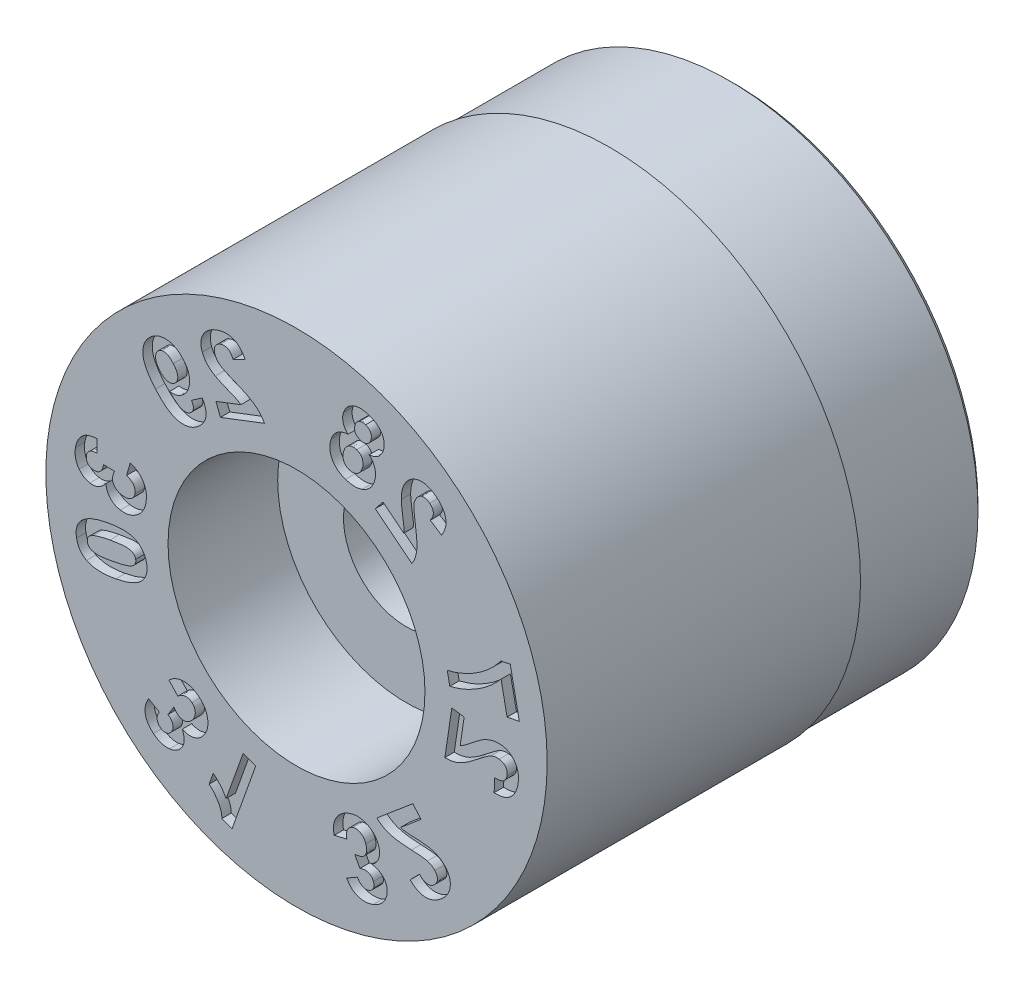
SolidWorks part; units mm, degrees
ref_plane "Front Plane" through (0, 0, 0) normal (0, 0, 1) x (1, 0, 0)
ref_plane "Top Plane" through (0, 0, 0) normal (0, 1, 0) x (1, 0, 0)
ref_plane "Right Plane" through (0, 0, 0) normal (1, 0, 0) x (0, 0, -1)
sketch "Sketch1" plane through (0, 0, 0) normal (1, 0, 0) x (0, 0, -1)
  line L2 (0, 8) -> (0, 4.1)
  line L3 (13.75, 8) -> (0, 8)
  line L4 (-3.7979, 0) -> (49996.2021, 0) construction
  line L8 (14, 2) -> (3.5, 2)
  line L9 (3.5, 4.1) -> (3.5, 2)
  line L10 (3.5, 4.1) -> (0, 4.1)
  line L12 (14, 2) -> (14, 7.75)
  line L16 (14, 7.75) -> (13.75, 8)
  dimension "D1" = 14
  dimension "D2" = 45
  dimension "D3" = 0.25
  dimension "D4" = 16
  dimension "D5" = 8.2
  dimension "D6" = 3.5
  dimension "D7" = 4
revolve "Revolve1" add sketch "Sketch1" angle 360 about L4
sketch "Sketch4" plane through (0, 0, 0) normal (1, 0, 0) x (0, 0, -1)
  line L0 (0, 0) -> (50000, 0) construction
  line L1 (14, -7.75) -> (14, 7.75) construction
  line L2 (10, 8.935) -> (14, 8.935)
  line L3 (10, 8.935) -> (10, 7.935)
  line L4 (10, 7.935) -> (14, 7.935)
  line L5 (14, 8.935) -> (14, 7.935)
  line L6 (13.75, 8) -> (0, 8) construction
  line L9 (0, 8.8) -> (0, -8.8) construction
  dimension "D1" = 1
  dimension "D2" = 0.065
  dimension "D3" = 10
revolve "Cut-Revolve1" cut sketch "Sketch4" angle 360 about L0
sketch "Sketch6" plane through (0, 0, 0) normal (0, 0, 1) x (1, 0, 0)
  arc A0 (4.7238, -1.5761) -> (4.4242, -2.2857) centre (0, 0) ccw construction
  text T0 "27  28  29  30  31  32" font "Arial" height 2.25
  dimension "D1" = 4.9798
extrude "Cut-Extrude1" cut sketch "Sketch6" against normal blind 0.3
